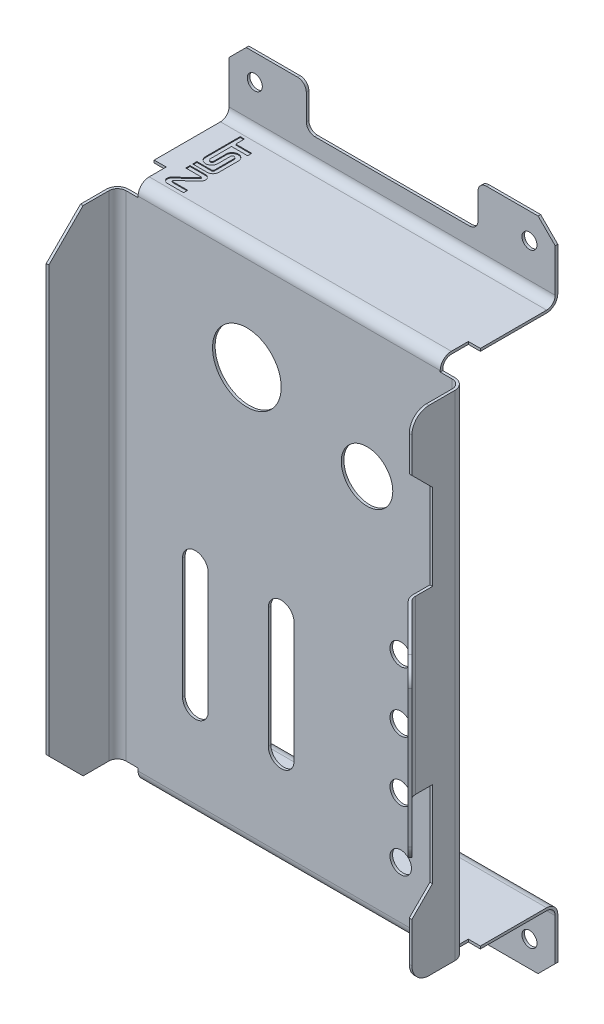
SolidWorks part; units mm, degrees
ref_plane "Front Plane" through (0, 0, 0) normal (0, 0, 1) x (1, 0, 0)
ref_plane "Top Plane" through (0, 0, 0) normal (0, 1, 0) x (1, 0, 0)
ref_plane "Right Plane" through (0, 0, 0) normal (1, 0, 0) x (0, 0, -1)
sketch "Sketch1" plane through (0, 0, 0) normal (1, 0, 0) x (0, 1, 0)
  line L0 (0, 0) -> (43.4848, 0)
  line L1 (51.7398, 8.255) -> (51.7398, 69.85)
  line L2 (58.0898, 76.2) -> (426.3898, 76.2)
  line L3 (432.7398, 69.85) -> (432.7398, 8.255)
  line L4 (440.9948, 0) -> (485.4448, 0)
  line L5 (0, 1.905) -> (43.4848, 1.905)
  line L6 (49.8348, 8.255) -> (49.8348, 69.85)
  line L7 (58.0898, 78.105) -> (426.3898, 78.105)
  line L8 (434.6448, 69.85) -> (434.6448, 8.255)
  line L9 (440.9948, 1.905) -> (485.4448, 1.905)
  line L10 (0, 0) -> (0, 1.905)
  line L11 (485.4448, 1.905) -> (485.4448, 0)
  arc A0 (440.9948, 0) -> (432.7398, 8.255) centre (440.9948, 8.255) cw
  arc A1 (51.7398, 8.255) -> (43.4848, 0) centre (43.4848, 8.255) cw
  arc A2 (432.7398, 69.85) -> (426.3898, 76.2) centre (426.3898, 69.85) ccw
  arc A3 (58.0898, 76.2) -> (51.7398, 69.85) centre (58.0898, 69.85) ccw
  arc A4 (49.8348, 8.255) -> (43.4848, 1.905) centre (43.4848, 8.255) cw
  arc A5 (58.0898, 78.105) -> (49.8348, 69.85) centre (58.0898, 69.85) ccw
  arc A6 (434.6448, 69.85) -> (426.3898, 78.105) centre (426.3898, 69.85) ccw
  arc A7 (440.9948, 1.905) -> (434.6448, 8.255) centre (440.9948, 8.255) cw
  dimension "D5" = 8.255
  dimension "D6" = 8.255
  dimension "D7" = 6.35
  dimension "D8" = 6.35
  dimension "D1" = 485.4448
  dimension "D2" = 381
  dimension "D3" = 52.705
  dimension "D4" = 76.2
  dimension "D9" = 1.905
extrude "Boss-Extrude1" add sketch "Sketch1" against normal blind 241.3
ref_plane "Plane1" through (0, 425.45, 0) normal (0, 1, 0) x (1, 0, 0)
sketch "Sketch2" plane through (0, 425.45, 0) normal (0, 1, 0) x (1, 0, 0)
  line L0 (-241.3, -78.105) -> (0, -78.105) construction
  line L1 (-241.3, -78.105) -> (0, -78.105)
  line L2 (-247.65, -84.455) -> (-247.65, -128.905)
  line L3 (6.35, -84.455) -> (6.35, -113.5634)
  line L4 (8.7678, -119.4006) -> (52.0527, -162.6854)
  line L5 (0, -8.255) -> (0, -69.85) construction
  line L6 (-241.3, -8.255) -> (-241.3, -69.85) construction
  line L7 (10.1149, -118.0535) -> (53.3997, -161.3384)
  line L8 (8.255, -84.455) -> (8.255, -113.5634)
  line L9 (-241.3, -76.2) -> (0, -76.2)
  line L10 (-249.555, -84.455) -> (-249.555, -128.905)
  line L11 (-249.555, -128.905) -> (-247.65, -128.905)
  line L12 (52.0527, -162.6854) -> (53.3997, -161.3384)
  arc A0 (6.35, -84.455) -> (0, -78.105) centre (0, -84.455) ccw
  arc A1 (6.35, -113.5634) -> (8.7678, -119.4006) centre (14.605, -113.5634) ccw
  arc A2 (-247.65, -84.455) -> (-241.3, -78.105) centre (-241.3, -84.455) cw
  arc A3 (8.255, -113.5634) -> (10.1149, -118.0535) centre (14.605, -113.5634) ccw
  arc A4 (8.255, -84.455) -> (0, -76.2) centre (0, -84.455) ccw
  arc A5 (-249.555, -84.455) -> (-241.3, -76.2) centre (-241.3, -84.455) cw
  dimension "D2" = 6.35
  dimension "D3" = 6.35
  dimension "D6" = 6.35
  dimension "D1" = 6.35
  dimension "D4" = 45
  dimension "D5" = 6.35
  dimension "D7" = 50.8
  dimension "D9" = 61.214
  dimension "D10" = 35.4584
  dimension "D8" = 1.905
extrude "Boss-Extrude2" add sketch "Sketch2" against normal blind 365.4552
sketch "Sketch3" plane through (6.35, 0, 0) normal (-1, 0, 0) x (0, 0, 1)
  line L0 (100.965, 371.6223) -> (100.965, 308.1274)
  line L1 (111.125, 34.6188) -> (242.3667, 34.6188)
  line L2 (242.3667, 34.6188) -> (242.3667, 181.1274)
  line L3 (242.3667, 443.5999) -> (111.125, 443.5999)
  line L4 (78.105, 59.9948) -> (78.105, 425.45) construction
  line L5 (100.965, 308.1274) -> (242.3667, 308.1274)
  line L6 (100.965, 117.6223) -> (111.125, 107.4623)
  line L7 (242.3667, 181.1274) -> (100.965, 181.1274)
  line L8 (89.477, 425.45) -> (-89.477, 425.45) construction
  line L9 (111.125, 443.5999) -> (111.125, 381.7823)
  line L10 (100.965, 181.1274) -> (100.965, 117.6223)
  line L11 (111.125, 107.4623) -> (111.125, 34.6188)
  line L12 (111.125, 381.7823) -> (100.965, 371.6223)
  line L13 (242.3667, 308.1274) -> (242.3667, 443.5999)
  dimension "D1" = 22.86
  dimension "D2" = 127
  dimension "D3" = 117.3226
  dimension "D4" = 33.02
  dimension "D5" = 135
  dimension "D6" = 135
  dimension "D7" = 53.8277
  dimension "D8" = 254
extrude "Cut-Extrude1" cut sketch "Sketch3" against normal blind 365.4552
other "Move Face2" parameters "D1"=5.08
sketch "Sketch4" plane through (0, 0, 1.905) normal (0, 0, 1) x (1, 0, 0)
  line L0 (-241.3, 485.4448) -> (0, 485.4448) construction
  line L1 (-184.15, 497.7776) -> (-57.15, 497.7776)
  line L2 (-184.15, 497.7776) -> (-184.15, 460.0448)
  line L3 (-177.8, 453.6948) -> (-63.5, 453.6948)
  line L4 (-57.15, 497.7776) -> (-57.15, 460.0448)
  line L5 (-184.15, -18.7616) -> (-57.15, -18.7616)
  line L6 (-184.15, -18.7616) -> (-184.15, 25.4)
  line L7 (-177.8, 31.75) -> (-63.5, 31.75)
  line L8 (-57.15, -18.7616) -> (-57.15, 25.4)
  line L9 (-241.3, 0) -> (0, 0) construction
  line L10 (0, 43.4848) -> (0, 0) construction
  line L11 (0, 485.4448) -> (0, 440.9948) construction
  arc A0 (-57.15, 25.4) -> (-63.5, 31.75) centre (-63.5, 25.4) ccw
  arc A1 (-177.8, 31.75) -> (-184.15, 25.4) centre (-177.8, 25.4) ccw
  arc A2 (-57.15, 460.0448) -> (-63.5, 453.6948) centre (-63.5, 460.0448) cw
  arc A3 (-177.8, 453.6948) -> (-184.15, 460.0448) centre (-177.8, 460.0448) cw
  dimension "D1" = 6.35
  dimension "D2" = 31.75
  dimension "D3" = 31.75
  dimension "D4" = 57.15
  dimension "D5" = 57.15
  dimension "D6" = 127
  dimension "D7" = 127
extrude "Cut-Extrude2" cut sketch "Sketch4" against normal through all
hole_wizard "7/16 (0.438) Diameter Hole1" positions "Sketch6" profile "Sketch5" hole size "#97" standard "ANSI Inch"
sketch "Sketch6" plane through (0, 0, 1.905) normal (0, 0, 1) x (1, 0, 0)
  line L0 (0, 43.4848) -> (0, 0) construction
  line L1 (-57.15, 0) -> (0, 0) construction
  line L2 (-241.3, 0) -> (-184.15, 0) construction
  line L3 (0, 485.4448) -> (0, 440.9948) construction
  point P0 (-19.05, 19.05)
  point P2 (-222.25, 19.05)
  point P4 (-19.05, 466.3948)
  point P6 (-222.25, 466.3948)
  dimension "D1" = 19.05
  dimension "D2" = 19.05
  dimension "D3" = 203.2
  dimension "D4" = 447.3448
  dimension "D5" = 203.2
  dimension "D6" = 447.3448
  dimension "D7" = 19.05
  dimension "D8" = 19.05
sketch "Sketch5" plane through (-19.05, 19.05, 1.905) normal (1, 0, 0) x (0, -1, 0)
  line L0 (0, 0) -> (0, 103.4183)
  line L1 (0, 103.4183) -> (5.5626, 100.076)
  line L2 (5.5626, 100.076) -> (5.5626, 0)
  line L5 (5.5626, 0) -> (0, 0)
  line L10 (0, 103.4183) -> (-5.5626, 100.076) construction
  line L11 (0, -6.35) -> (0, 107.95) construction
  dimension "Hole Dia." = 11.1252
  dimension "Hole Depth" = 100.076
  dimension "Drill Angle" = 118
sketch "Sketch7" plane through (0, 0, 78.105) normal (0, 0, 1) x (1, 0, 0)
  line L1 (0, 43.4848) -> (0, 0) construction
  line L2 (-199.5424, 210.9724) -> (-199.5424, 122.0724)
  line L3 (-241.3, 0) -> (-184.15, 0) construction
  line L4 (-180.4924, 210.9724) -> (-180.4924, 122.0724)
  line L5 (-57.15, 0) -> (0, 0) construction
  line L6 (-136.0424, 122.0724) -> (-136.0424, 210.9724)
  line L8 (-116.9924, 122.0724) -> (-116.9924, 210.5772)
  circle A0 centre (-151.9133, 356.9208) radius 25.4
  circle A1 centre (-63.0133, 331.5208) radius 19.05
  arc A2 (-199.5424, 210.9724) -> (-180.4924, 210.9724) centre (-190.0174, 210.9724) cw
  arc A3 (-136.0424, 210.9724) -> (-116.9924, 210.5772) centre (-126.5133, 210.9724) cw
  arc A4 (-116.9924, 122.0724) -> (-136.0424, 122.0724) centre (-126.5174, 122.0724) cw
  arc A5 (-199.5424, 122.0724) -> (-180.4924, 122.0724) centre (-190.0174, 122.0724) ccw
  dimension "D7" = 9.525
  dimension "D8" = 9.5291
  dimension "D9" = 9.525
  dimension "D10" = 9.525
  dimension "D3" = 25.4
  dimension "D17" = 38.1
  dimension "D18" = 50.8
  dimension "D1" = 19.05
  dimension "D2" = 19.05
  dimension "D4" = 126.5174
  dimension "D5" = 122.0724
  dimension "D6" = 122.0724
  dimension "D11" = 88.9
  dimension "D12" = 88.9
  dimension "D13" = 63.5
  dimension "D14" = 25.4
  dimension "D15" = 331.5208
  dimension "D16" = 88.9
extrude "Cut-Extrude3" cut sketch "Sketch7" against normal through all
hole_wizard "5/8 (0.625) Diameter Hole1" positions "Sketch9" profile "Sketch8" hole size "5/8" standard "ANSI Inch"
sketch "Sketch9" plane through (0, 0, 78.105) normal (0, 0, 1) x (1, 0, 0)
  line L0 (0, 43.4848) -> (0, 0) construction
  line L1 (-57.15, 0) -> (0, 0) construction
  line L2 (-38.1, 96.774) -> (-38.1, 282.0939) construction
  point P0 (-38.1, 96.774)
  point P2 (-38.1, 141.224)
  point P4 (-38.1, 185.674)
  point P6 (-38.1, 230.124)
  dimension "D1" = 38.1
  dimension "D2" = 96.774
  dimension "D3" = 44.45
  dimension "D4" = 44.45
  dimension "D5" = 44.45
sketch "Sketch8" plane through (-38.1, 96.774, 78.105) normal (1, 0, 0) x (0, -1, 0)
  line L0 (0, 0) -> (0, 104.8453)
  line L1 (0, 104.8453) -> (7.9375, 100.076)
  line L2 (7.9375, 100.076) -> (7.9375, 0)
  line L5 (7.9375, 0) -> (0, 0)
  line L10 (0, 104.8453) -> (-7.9375, 100.076) construction
  line L11 (0, -6.35) -> (0, 107.95) construction
  dimension "Hole Dia." = 15.875
  dimension "Hole Depth" = 100.076
  dimension "Drill Angle" = 118
hole_wizard "5/8 (0.625) Diameter Hole2" positions "Sketch11" profile "Sketch10" hole size "5/8" standard "ANSI Inch"
sketch "Sketch11" plane through (-55.3164, 0, 55.3164) normal (-0.7071, 0, 0.7071) x (0.7071, 0, 0.7071)
  line L0 (151.8427, 181.1274) -> (90.6287, 181.1274) construction
  line L2 (151.8427, 181.1274) -> (151.8427, 308.1274) construction
  point P0 (121.3627, 244.6274)
  dimension "D1" = 63.5
  dimension "D2" = 30.48
sketch "Sketch10" plane through (30.5001, 244.6274, 141.1328) normal (0, 1, 0) x (0.7071, 0, 0.7071)
  line L0 (0, 0) -> (0, 115.9885)
  line L1 (0, 115.9885) -> (13.5255, 115.9885)
  line L2 (13.5255, 115.9885) -> (13.5255, 0)
  line L5 (13.5255, 0) -> (0, 0)
  line L11 (0, -6.35) -> (0, 107.95) construction
  dimension "Thru Hole Dia." = 27.051
  dimension "Thru Hole Depth" = 115.9885
hole_wizard "3/16 (0.1875) Diameter Hole1" positions "Sketch13" profile "Sketch12" hole size "3/16" standard "ANSI Inch"
sketch "Sketch13" plane through (-55.3164, 0, 55.3164) normal (-0.7071, 0, 0.7071) x (0.7071, 0, 0.7071)
  line L0 (151.8427, 181.1274) -> (90.6287, 181.1274) construction
  line L1 (151.8427, 181.1274) -> (151.8427, 308.1274) construction
  point P0 (139.1427, 225.5774)
  point P7 (139.1427, 263.6774)
  point P9 (107.3927, 263.6774)
  point P11 (107.3927, 225.5774)
  dimension "D1" = 44.45
  dimension "D2" = 12.7
  dimension "D3" = 38.1
  dimension "D4" = 44.45
  dimension "D5" = 38.1
  dimension "D6" = 31.75
  dimension "D7" = 31.75
  dimension "D8" = 12.7
sketch "Sketch12" plane through (43.0724, 225.5774, 153.7051) normal (0, 1, 0) x (0.7071, 0, 0.7071)
  line L0 (0, 0) -> (0, 101.5106)
  line L1 (0, 101.5106) -> (2.3876, 100.076)
  line L2 (2.3876, 100.076) -> (2.3876, 0)
  line L5 (2.3876, 0) -> (0, 0)
  line L10 (0, 101.5106) -> (-2.3876, 100.076) construction
  line L11 (0, -6.35) -> (0, 107.95) construction
  dimension "Hole Dia." = 4.7752
  dimension "Hole Depth" = 100.076
  dimension "Drill Angle" = 118
sketch "Sketch14" plane through (0, 0, 78.105) normal (0, 0, 1) x (1, 0, 0)
  line L0 (-363.9522, 242.7224) -> (175.1441, 242.7224) construction
  line L1 (-57.15, 0) -> (0, 0) construction
  line L2 (-120.65, 497.5763) -> (-120.65, -28.6626) construction
  line L3 (0, 43.4848) -> (0, 0) construction
  line L4 (-241.3, 49.8348) -> (0, 49.8348) construction
  line L5 (39.8693, 49.8348) -> (-8.89, 49.8348)
  line L6 (39.8693, 49.8348) -> (39.8693, 59.9948)
  line L7 (39.8693, 59.9948) -> (-8.89, 59.9948)
  line L8 (-8.89, 49.8348) -> (-8.89, 59.9948)
  line L9 (0, 49.8348) -> (0, 58.0898) construction
  line L10 (-281.1693, 49.8348) -> (-281.1693, 59.9948)
  line L11 (-281.1693, 59.9948) -> (-232.41, 59.9948)
  line L12 (-232.41, 49.8348) -> (-232.41, 59.9948)
  line L13 (-281.1693, 49.8348) -> (-232.41, 49.8348)
  line L14 (-281.1693, 435.61) -> (-232.41, 435.61)
  line L15 (-232.41, 435.61) -> (-232.41, 425.45)
  line L16 (-281.1693, 425.45) -> (-232.41, 425.45)
  line L17 (-281.1693, 435.61) -> (-281.1693, 425.45)
  line L18 (-8.89, 435.61) -> (-8.89, 425.45)
  line L19 (39.8693, 425.45) -> (-8.89, 425.45)
  line L20 (39.8693, 435.61) -> (39.8693, 425.45)
  line L21 (39.8693, 435.61) -> (-8.89, 435.61)
  dimension "D1" = 242.7224
  dimension "D2" = 120.65
  dimension "D3" = 10.16
  dimension "D4" = 48.7593
  dimension "D5" = 0
  dimension "D6" = 8.89
extrude "Cut-Extrude4" cut sketch "Sketch14" against normal blind 20.828
fillet "Fillet1" radius 6.35 2 edges at (-184.15, 485.4448, 0.9525) (-57.15, 485.4448, 0.9525)
chamfer "Chamfer1" distance 12.7 angle 45 4 edges at (0, 0, 0.9525) (-241.3, 0, 0.9525) (-241.3, 485.4448, 0.9525) (0, 485.4448, 0.9525)
chamfer "Chamfer2" distance 25.4 angle 45 2 edges at (-248.6025, 59.9948, 128.905) (-248.6025, 425.45, 128.905)
fillet "Fillet2" radius 12.7 4 edges at (7.3025, 59.9948, 116.205) (7.3025, 425.45, 116.205) (52.7262, 308.1274, 162.0119) (52.7262, 181.1274, 162.0119)
ref_point "Point1"
ref_point "Point2"
ref_point "Point3"
sketch "Sketch16" plane through (0, 434.6448, 0) normal (0, 1, 0) x (1, 0, 0)
  line L0 (-224.55, -45.5289) -> (-213.7457, -45.5289)
  line L1 (-209.55, -41.3332) -> (-209.55, -26.1327)
  line L2 (-218.5729, -26.1327) -> (-218.5729, -35.7594)
  line L3 (-221.389, -35.6445) -> (-221.389, -19.9544)
  line L4 (-221.389, -19.9544) -> (-209.55, -19.9544)
  line L5 (-209.55, -19.9544) -> (-209.55, -16.8519)
  line L6 (-209.55, -16.8519) -> (-221.389, -16.8519)
  line L7 (-221.389, -16.8519) -> (-221.389, -10.4426)
  line L8 (-221.389, -10.4426) -> (-224.55, -10.4426)
  line L9 (-224.55, -10.4426) -> (-224.55, -36.0459)
  line L10 (-215.4696, -35.7019) -> (-215.4696, -26.6501)
  line L11 (-212.6532, -26.5926) -> (-212.6532, -41.3041)
  line L12 (-213.7457, -42.3966) -> (-224.55, -42.3966)
  line L13 (-224.55, -42.3966) -> (-224.55, -45.5289)
  line L14 (-209.55, -67.31) -> (-221.7121, -67.31)
  line L15 (-223.9261, -61.6548) -> (-212.8257, -51.39)
  line L16 (-213.1419, -50.6723) -> (-224.55, -50.6723)
  line L17 (-224.55, -50.6723) -> (-224.55, -47.5401)
  line L18 (-224.55, -47.5401) -> (-213.0671, -47.5401)
  line L19 (-210.8694, -53.8032) -> (-221.159, -63.2703)
  line L20 (-220.7935, -64.2075) -> (-209.55, -64.2075)
  line L21 (-209.55, -64.2075) -> (-209.55, -67.31)
  arc A0 (-213.7457, -45.5289) -> (-209.55, -41.3332) centre (-213.7457, -41.3332) ccw
  arc A1 (-209.55, -26.1327) -> (-218.5729, -26.1327) centre (-214.0615, -26.8511) ccw
  arc A2 (-221.389, -35.6445) -> (-218.5729, -35.7594) centre (-219.9833, -35.7594) ccw
  arc A3 (-224.55, -36.0459) -> (-215.4696, -35.7019) centre (-220.0033, -36.0459) ccw
  arc A4 (-212.6532, -26.5926) -> (-215.4696, -26.6501) centre (-214.0583, -26.7728) ccw
  arc A5 (-223.9261, -61.6548) -> (-221.7121, -67.31) centre (-221.7121, -64.049) ccw
  arc A6 (-212.8257, -51.39) -> (-213.1419, -50.6723) centre (-213.1072, -51.0855) ccw
  arc A7 (-221.159, -63.2703) -> (-220.7935, -64.2075) centre (-220.7935, -63.6676) ccw
  arc A8 (-213.7457, -42.3966) -> (-212.6532, -41.3041) centre (-213.7457, -41.3041) ccw
  arc A9 (-210.8694, -53.8032) -> (-213.0671, -47.5401) centre (-213.0671, -51.0572) ccw
extrude "Cut-Extrude5" cut sketch "Sketch16" against normal blind 0.635
